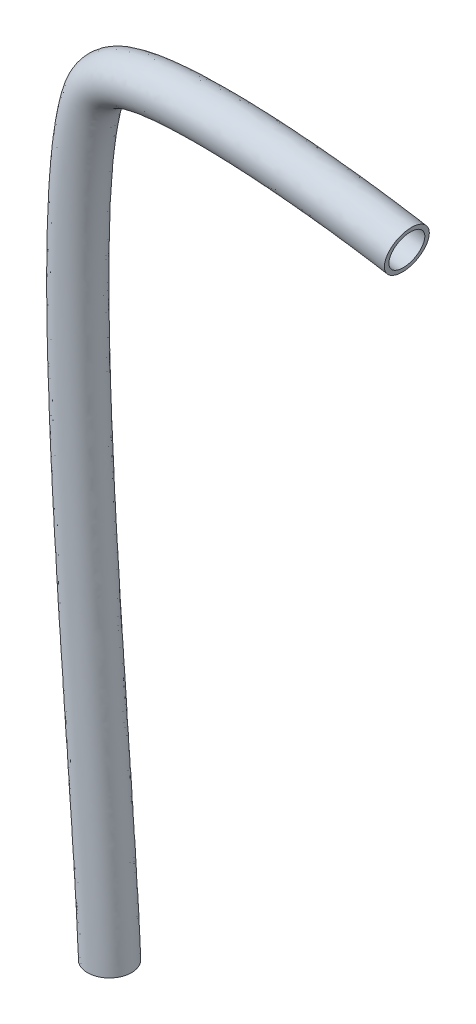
SolidWorks part; units mm, degrees
ref_plane "Alzado" through (0, 0, 0) normal (0, 0, 1) x (1, 0, 0)
ref_plane "Planta" through (0, 0, 0) normal (0, 1, 0) x (1, 0, 0)
ref_plane "Vista lateral" through (0, 0, 0) normal (1, 0, 0) x (0, 0, -1)
sketch "Croquis4" plane through (0, 0, 0) normal (0, 1, 0) x (1, 0, 0)
  circle A0 centre (0, 0) radius 5
  circle A1 centre (0, 0) radius 4
  dimension "D1" = 10
  dimension "D2" = 8
sketch "Croquis5" plane through (0, 0, 0) normal (0, 0, 1) x (1, 0, 0)
  line L0 (0, 0) -> (0, 173.36) construction
  line L1 (5, 0) -> (-5, 0) construction
  line L2 (0, 173.36) -> (67.49, 173.36) construction
  spline S0 degree 3 poles (0, 0) (-1.3586, 37.0494) (-13.6021, 147.0811) (1.331, 180.4835) (44.2686, 177.2949) (67.49, 173.36) knots 0 0 0 0 0.678477 0.778477 1 1 1 1
  dimension "D1" = 173.36
  dimension "D2" = 67.49
sweep "Barrer2" add profiles "Croquis4" path "Croquis5"
